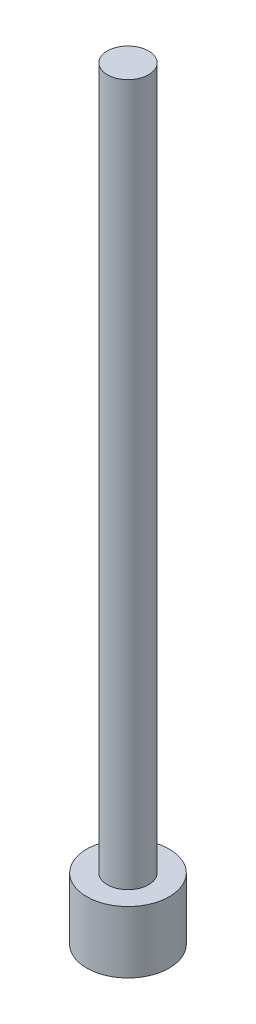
SolidWorks part; units mm, degrees
ref_plane "Plan de face" through (0, 0, 0) normal (0, 0, 1) x (1, 0, 0)
ref_plane "Plan de dessus" through (0, 0, 0) normal (0, 1, 0) x (1, 0, 0)
ref_plane "Plan de droite" through (0, 0, 0) normal (1, 0, 0) x (0, 0, -1)
sketch "Esquisse1" plane through (0, 0, 0) normal (0, 1, 0) x (1, 0, 0)
  circle A0 centre (0, 0) radius 2
  dimension "D1" = 4
extrude "Extrusion1" add sketch "Esquisse1" along normal blind 3
sketch "Esquisse2" plane through (0, 3, 0) normal (0, 1, 0) x (-1, 0, 0)
  circle A0 centre (0, 0) radius 1
  dimension "D1" = 2
extrude "Extrusion2" add sketch "Esquisse2" along normal blind 34
